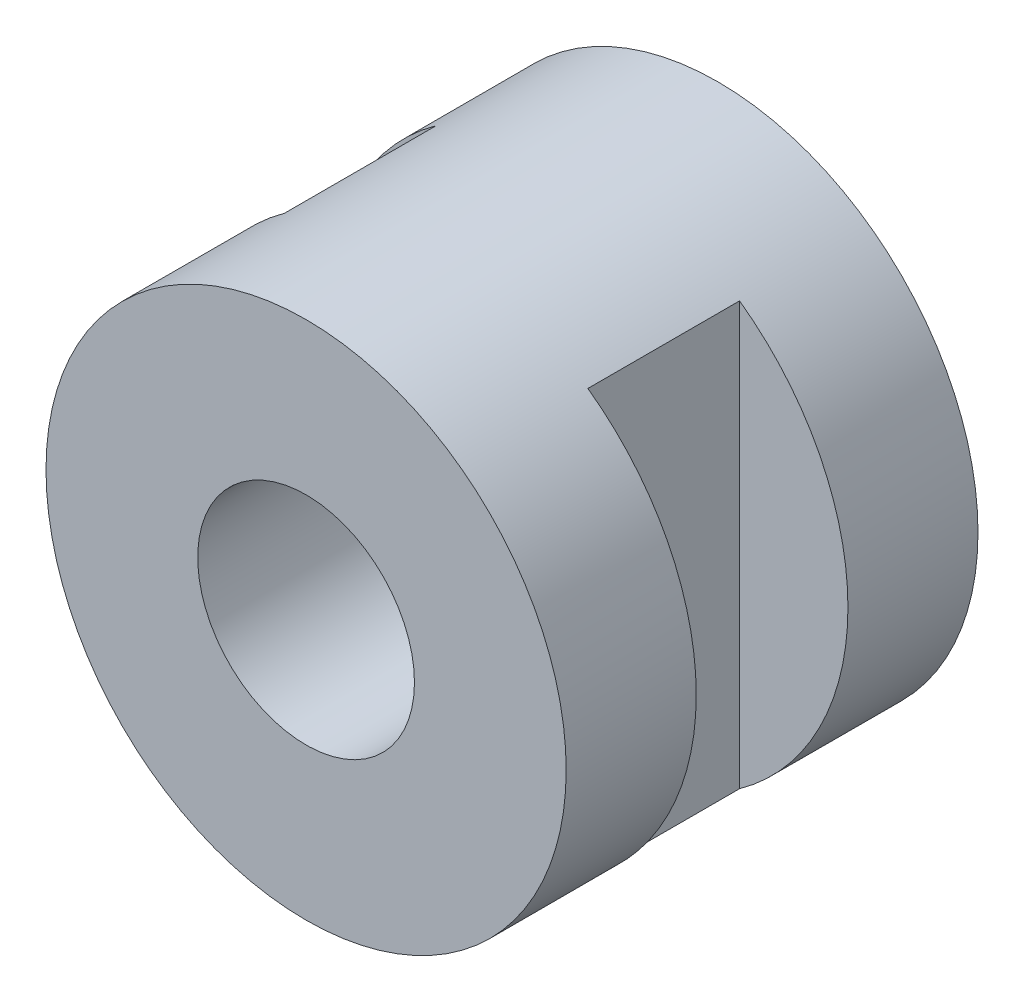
SolidWorks part; units mm, degrees
ref_plane "前视基准面" through (0, 0, 0) normal (0, 0, 1) x (1, 0, 0)
ref_plane "上视基准面" through (0, 0, 0) normal (0, 1, 0) x (1, 0, 0)
ref_plane "右视基准面" through (0, 0, 0) normal (1, 0, 0) x (0, 0, -1)
sketch "草图1" plane through (0, 0, 0) normal (0, 0, 1) x (1, 0, 0)
  circle A0 centre (0, 0) radius 6
extrude "凸台-拉伸1" add sketch "草图1" along normal blind 9.5
sketch "草图2" plane through (0, 0, 9.5) normal (0, 0, 1) x (1, 0, 0)
  circle A0 centre (0, 0) radius 2.5
extrude "切除-拉伸1" cut sketch "草图2" against normal blind 9.5
ref_plane "基准面1" through (0, 0, 0) normal (0, 1, 0) x (-1, 0, 0)
sketch "草图3" plane through (0, 0, 0) normal (0, 1, 0) x (-1, 0, 0)
  line L0 (-6, 9.5) -> (-6, 0) construction
  line L1 (-6.2206, 6.5) -> (-3.5, 6.5)
  line L2 (-6.2206, 6.5) -> (-6.2206, 3)
  line L3 (-6.2206, 3) -> (-3.5, 3)
  line L4 (-3.5, 6.5) -> (-3.5, 3)
  line L5 (0, 9.5) -> (0, 0) construction
  line L6 (6, 9.5) -> (-6, 9.5) construction
  line L7 (0, 4.75) -> (5.9878, 4.75) construction
  line L10 (6.2206, 6.5) -> (6.2206, 3)
  line L11 (6.2206, 3) -> (3.5, 3)
  line L12 (3.5, 6.5) -> (3.5, 3)
  line L13 (6.2206, 6.5) -> (3.5, 6.5)
  dimension "D1" = 2.5
  dimension "D2" = 3.5
extrude "切除-拉伸2" cut sketch "草图3" against normal through all and the other way through all
